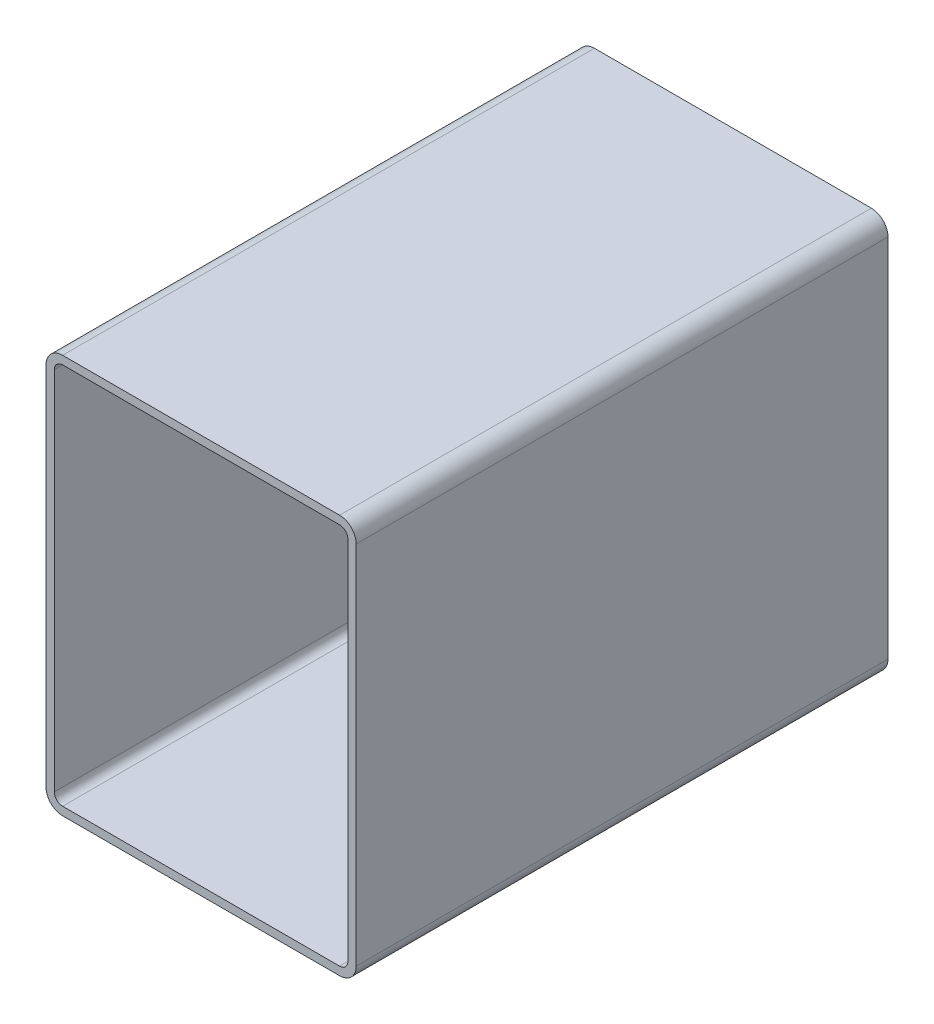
SolidWorks part; units mm, degrees
ref_plane "Front Plane" through (0, 0, 0) normal (0, 0, 1) x (1, 0, 0)
ref_plane "Top Plane" through (0, 0, 0) normal (0, 1, 0) x (1, 0, 0)
ref_plane "Right Plane" through (0, 0, 0) normal (1, 0, 0) x (0, 0, -1)
sketch "Sketch1" plane through (0, 0, 0) normal (0, 0, 1) x (1, 0, 0)
sketch_block_instance "HSS9x7x0.1875-1"
sketch_block "HSS9x7x0.1875"
extrude "Boss-Extrude1" add sketch "Sketch1" along normal blind 304.8
